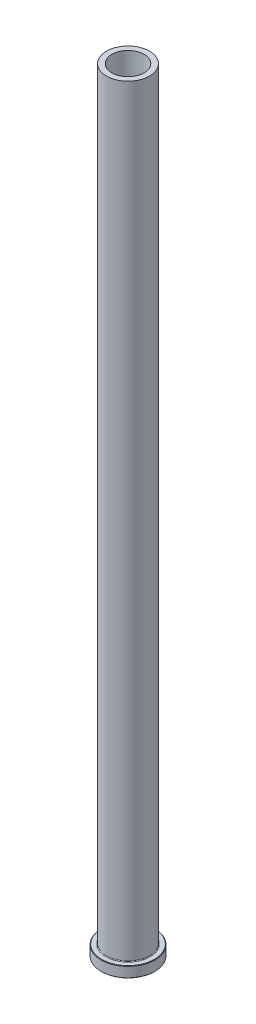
SolidWorks part; units mm, degrees
ref_plane "Front Plane" through (0, 0, 0) normal (0, 0, 1) x (1, 0, 0)
ref_plane "Top Plane" through (0, 0, 0) normal (0, 1, 0) x (1, 0, 0)
ref_plane "Right Plane" through (0, 0, 0) normal (1, 0, 0) x (0, 0, -1)
sketch "Sketch1" plane through (0, 0, 0) normal (0, 0, 1) x (1, 0, 0)
  line L0 (0, 0) -> (0, 50000) construction
  line L1 (0, 0) -> (15.875, 0)
  line L2 (15.875, 0) -> (15.875, 6.35)
  line L3 (15.875, 6.35) -> (13.154, 6.35)
  line L4 (12.7571, 6.7469) -> (12.7571, 457.2)
  line L5 (12.7571, 457.2) -> (0, 457.2)
  line L6 (0, 457.2) -> (0, 0)
  arc A0 (12.7571, 6.7469) -> (13.154, 6.35) centre (13.154, 6.7469) ccw
  dimension "D5" = 0.3969
  dimension "D1" = 25.5143
  dimension "D2" = 31.75
  dimension "D3" = 6.35
  dimension "D4" = 457.2
revolve "Revolve1" add sketch "Sketch1" angle 360 about L0
sketch "Sketch2" plane through (0, 0, 0) normal (0, 0, 1) x (1, 0, 0)
  line L0 (0, 0) -> (0, 50000) construction
  line L1 (-15.875, 0) -> (15.875, 0) construction
  line L2 (10.1124, 0) -> (9.7155, 0.3969)
  line L3 (9.7155, 0.3969) -> (9.7155, 360.3625)
  line L4 (9.7155, 360.3625) -> (9.525, 374.65)
  line L5 (9.525, 374.65) -> (9.525, 457.2)
  line L6 (12.7571, 457.2) -> (-12.7571, 457.2) construction
  line L7 (9.525, 457.2) -> (0, 457.2)
  line L8 (0, 457.2) -> (0, 0)
  line L9 (0, 0) -> (10.1124, 0)
  point P4 (0, 0)
  dimension "D1" = 0.3969
  dimension "D2" = 45
  dimension "D3" = 19.05
  dimension "D4" = 19.431
  dimension "D5" = 82.55
  dimension "D6" = 14.2875
revolve "Cut-Revolve1" cut sketch "Sketch2" angle 360 about L0
chamfer "Chamfer1" distance 0.254 angle 45 2 edges at (0, 0, -15.875) (0, 6.35, -15.875)
